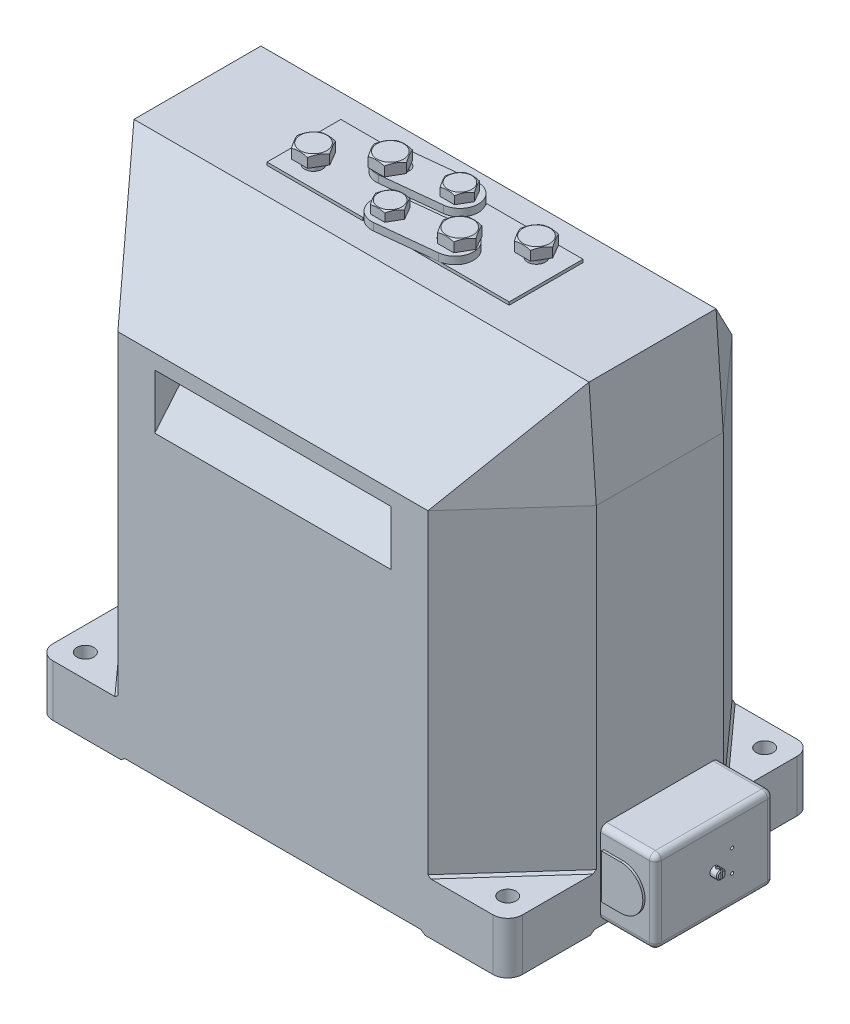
SolidWorks part; units mm, degrees
ref_plane "Front Plane" through (0, 0, 0) normal (0, 0, 1) x (1, 0, 0)
ref_plane "Top Plane" through (0, 0, 0) normal (0, 1, 0) x (1, 0, 0)
ref_plane "Right Plane" through (0, 0, 0) normal (1, 0, 0) x (0, 0, -1)
other "Join1"
other "HlTmCsDIN933<6>@24305_AM-40a_Körvonalrajzhoz"
other "HlTmCsDIN933<7>@24305_AM-40a_Körvonalrajzhoz"
other "HlTmCsDIN933<5>@24305_AM-40a_Körvonalrajzhoz"
other "HlTmCsDIN933<4>@24305_AM-40a_Körvonalrajzhoz"
other "HlTmCsDIN933<3>@24305_AM-40a_Körvonalrajzhoz"
other "HlTmCsDIN933<2>@24305_AM-40a_Körvonalrajzhoz"
other "24205-124_ÁtkötőLamella<2>@24305_AM-40a_Körvonalrajzhoz"
other "24205-124_ÁtkötőLamella<1>@24305_AM-40a_Körvonalrajzhoz"
other "HlTmCsDIN933<1>@24305_AM-40a_Körvonalrajzhoz"
other "21105-115_PlombaCsavar<1>@24305_AM-40a_Körvonalrajzhoz"
other "FME12_Tömszelence_29519_112<2>@24305_AM-40a_Körvonalrajzhoz"
other "FME12_TRA_Kapocsfedél_29519_113<1>@24305_AM-40a_Körvonalrajzhoz"
other "FME12_Tömszelence_29519_112<1>@24305_AM-40a_Körvonalrajzhoz"
other "AM40a_TRA_Kiöntött_Körvonalrajzhoz<1>@24305_AM-40a_Körvonalrajzhoz/AM40a_TRA_Test_T24305<1>@AM40a_TRA_Kiöntött_Körvonalrajzhoz"
